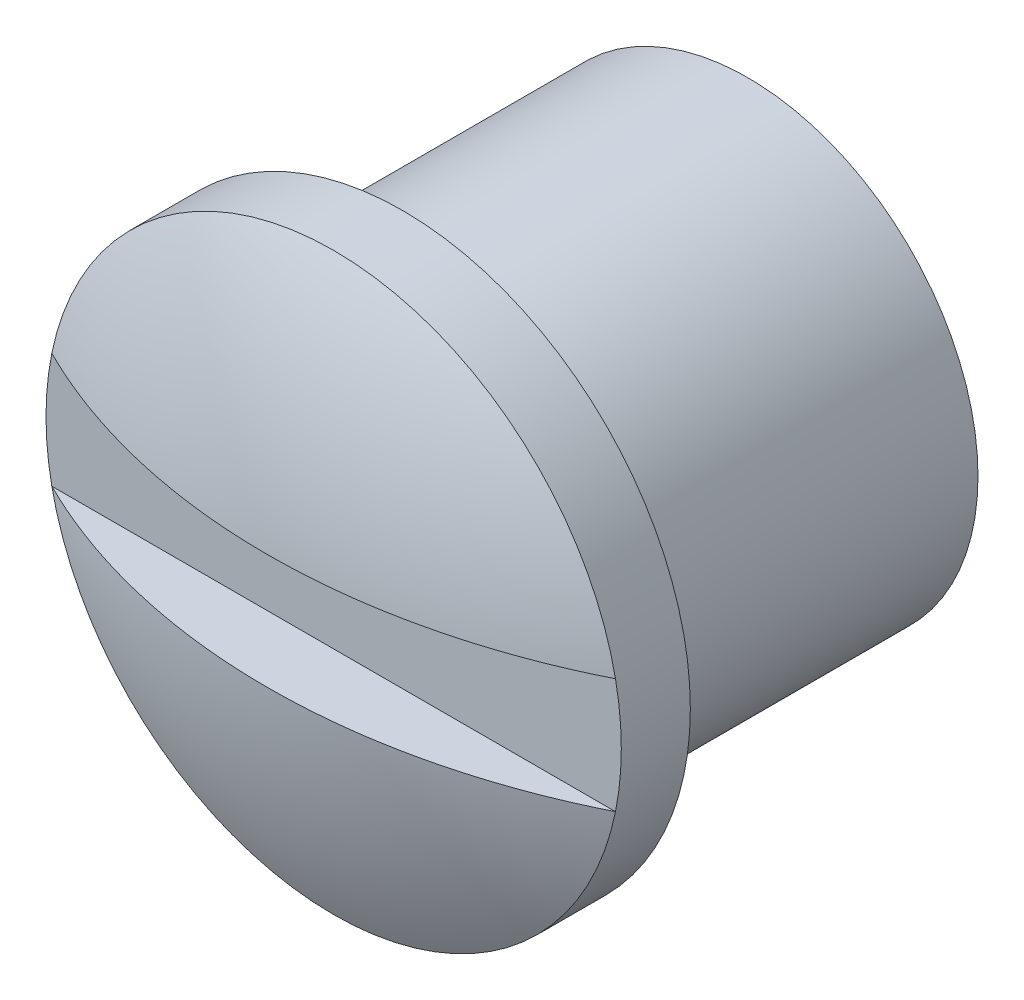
SolidWorks part; units mm, degrees
ref_plane "前视基准面" through (0, 0, 0) normal (0, 0, 1) x (1, 0, 0)
ref_plane "上视基准面" through (0, 0, 0) normal (0, 1, 0) x (1, 0, 0)
ref_plane "右视基准面" through (0, 0, 0) normal (1, 0, 0) x (0, 0, -1)
sketch "草图1" plane through (0, 0, 0) normal (0, 0, 1) x (1, 0, 0)
  circle A0 centre (0, 0) radius 10
  dimension "D1" = 20
extrude "凸台-拉伸1" add sketch "草图1" along normal blind 15
sketch "草图2" plane through (0, 0, 15) normal (0, 0, 1) x (1, 0, 0)
  circle A0 centre (0, 0) radius 12.5
  dimension "D1" = 25
extrude "凸台-拉伸2" add sketch "草图2" along normal blind 3
sketch "草图3" plane through (0, 0, 0) normal (0, 1, 0) x (1, 0, 0)
  line L0 (0, -18) -> (0, -21)
  line L1 (-12.5, -18) -> (12.5, -18) construction
  line L2 (12.5, -18) -> (0, -18)
  arc A0 (0, -21) -> (12.5, -18) centre (0, 6.5417) ccw
  dimension "D1" = 3
revolve "旋转1" add sketch "草图3" angle 360 about L0
ref_plane "基准面1" through (0, 0, 21) normal (0, 0, -1) x (-1, 0, 0)
sketch "草图4" plane through (0, 0, 21) normal (0, 0, -1) x (-1, 0, 0)
  line L1 (37.5, 2.5) -> (-37.5, 2.5)
  line L2 (37.5, 2.5) -> (37.5, -2.5)
  line L3 (37.5, -2.5) -> (-37.5, -2.5)
  line L4 (-37.5, 2.5) -> (-37.5, -2.5)
  line L5 (37.5, 2.5) -> (-37.5, -2.5) construction
  line L6 (37.5, -2.5) -> (-37.5, 2.5) construction
  point P0 (0, 0)
  dimension "D1" = 5
  dimension "D2" = 75
extrude "切除-拉伸1" cut sketch "草图4" along normal blind 3
